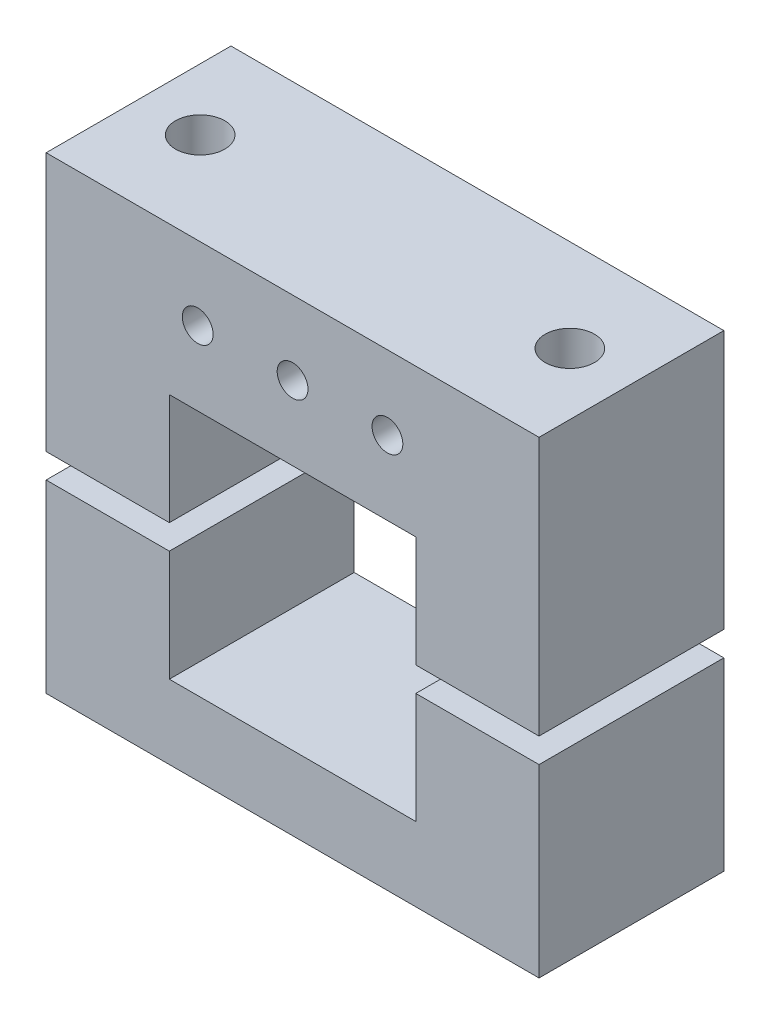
SolidWorks part; units mm, degrees
ref_plane "Front Plane" through (0, 0, 0) normal (0, 0, 1) x (1, 0, 0)
ref_plane "Top Plane" through (0, 0, 0) normal (0, 1, 0) x (1, 0, 0)
ref_plane "Right Plane" through (0, 0, 0) normal (1, 0, 0) x (0, 0, -1)
sketch "Sketch1" plane through (0, 0, 0) normal (0, 0, 1) x (1, 0, 0)
  line L0 (-402.3895, 11.2947) -> (-382.3895, 11.2947)
  line L1 (-382.3895, 11.2947) -> (-382.3895, 2.2947)
  line L2 (-382.3895, -8.7053) -> (-402.3895, -8.7053)
  line L3 (-402.3895, 2.2947) -> (-412.3895, 2.2947)
  line L5 (-392.3895, 23.2947) -> (-392.3895, 11.2947) construction
  line L6 (-392.3895, 23.2947) -> (-412.3895, 23.2947)
  line L7 (-412.3895, 23.2947) -> (-412.3895, 2.2947)
  line L8 (-382.3895, 2.2947) -> (-372.3895, 2.2947)
  line L9 (-392.3895, 23.2947) -> (-372.3895, 23.2947)
  line L10 (-372.3895, 23.2947) -> (-372.3895, 2.2947)
  line L11 (-392.3895, 11.2947) -> (-382.3895, 11.2947) construction
  line L12 (-402.3895, 11.2947) -> (-402.3895, 2.2947)
  line L15 (-372.3895, -14.7053) -> (-372.3895, 0.2947)
  line L16 (-382.3895, 0.2947) -> (-372.3895, 0.2947)
  line L17 (-402.3895, 0.2947) -> (-412.3895, 0.2947)
  line L18 (-412.3895, -14.7053) -> (-412.3895, 0.2947)
  line L19 (-402.3895, 0.2947) -> (-402.3895, -8.7053)
  line L20 (-382.3895, 0.2947) -> (-382.3895, -8.7053)
  line L21 (-412.3895, -14.7053) -> (-372.3895, -14.7053)
  circle A0 centre (-384.6916, 17.2947) radius 1.25
  circle A1 centre (-392.3895, 17.2947) radius 1.25
  circle A2 centre (-400.0875, 17.2947) radius 1.25
extrude "Boss-Extrude1" add sketch "Sketch1" along normal blind 15
sketch "Sketch4" plane through (0, 23.2947, 0) normal (0, 1, 0) x (-1, 0, 0)
  line L0 (412.3895, 15) -> (402.3895, 15) construction
  line L1 (372.3895, 15) -> (412.3895, 15) construction
  line L2 (392.3895, 15) -> (392.3895, 0) construction
  line L3 (402.3895, 15) -> (412.3895, 0) construction
  line L4 (372.3895, 0) -> (412.3895, 0) construction
  circle A0 centre (407.3895, 7.5) radius 2
  circle A1 centre (377.3895, 7.5) radius 2
extrude "Cut-Extrude1" cut sketch "Sketch4" against normal blind 66
